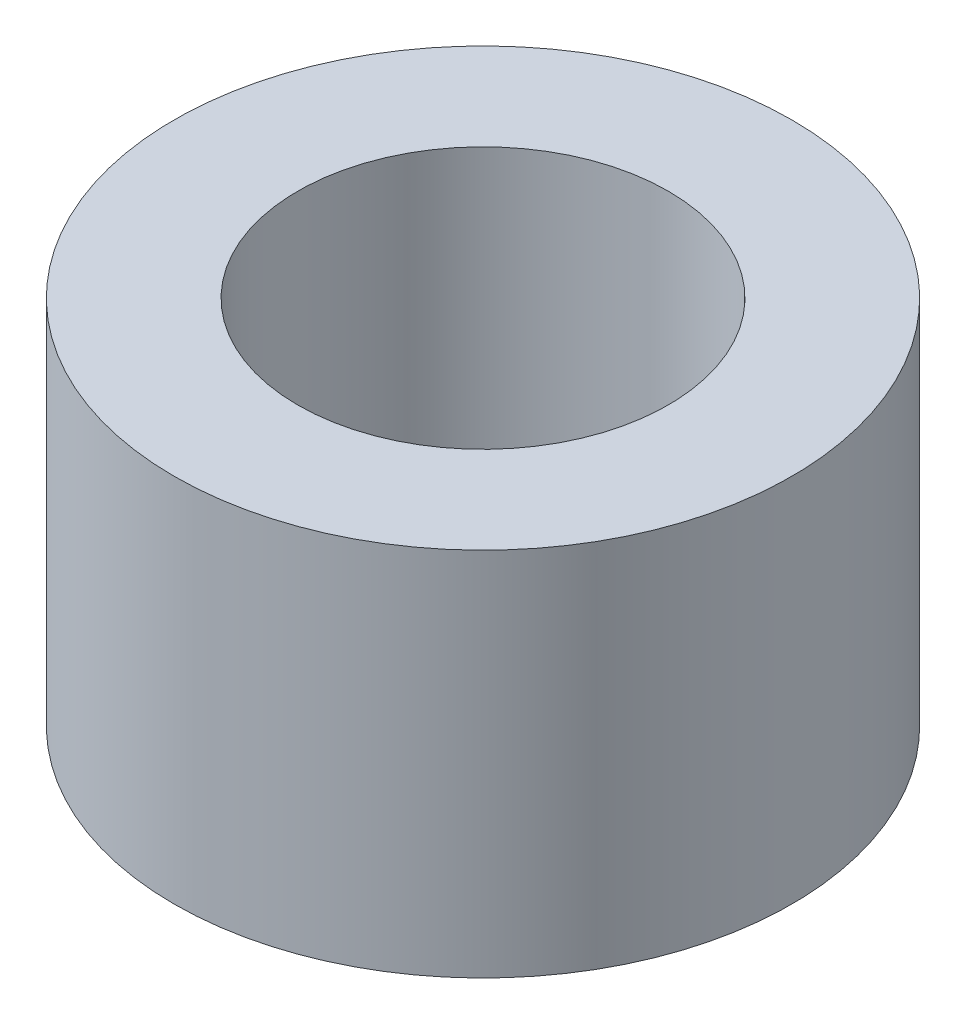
SolidWorks part; units mm, degrees
ref_plane "Front Plane" through (0, 0, 0) normal (0, 0, 1) x (1, 0, 0)
ref_plane "Top Plane" through (0, 0, 0) normal (0, 1, 0) x (1, 0, 0)
ref_plane "Right Plane" through (0, 0, 0) normal (1, 0, 0) x (0, 0, -1)
sketch "Sketch1" plane through (0, 0, 0) normal (0, 1, 0) x (1, 0, 0)
  circle A0 centre (0, 0) radius 2.5
  dimension "D1" = 5
extrude "Boss-Extrude1" add sketch "Sketch1" along normal blind 3 contours A0
sketch "Sketch2" plane through (0, 3, 0) normal (0, 1, 0) x (1, 0, 0)
  circle A0 centre (0, 0) radius 1.5
  dimension "D1" = 3
extrude "Cut-Extrude1" cut sketch "Sketch2" against normal through all
